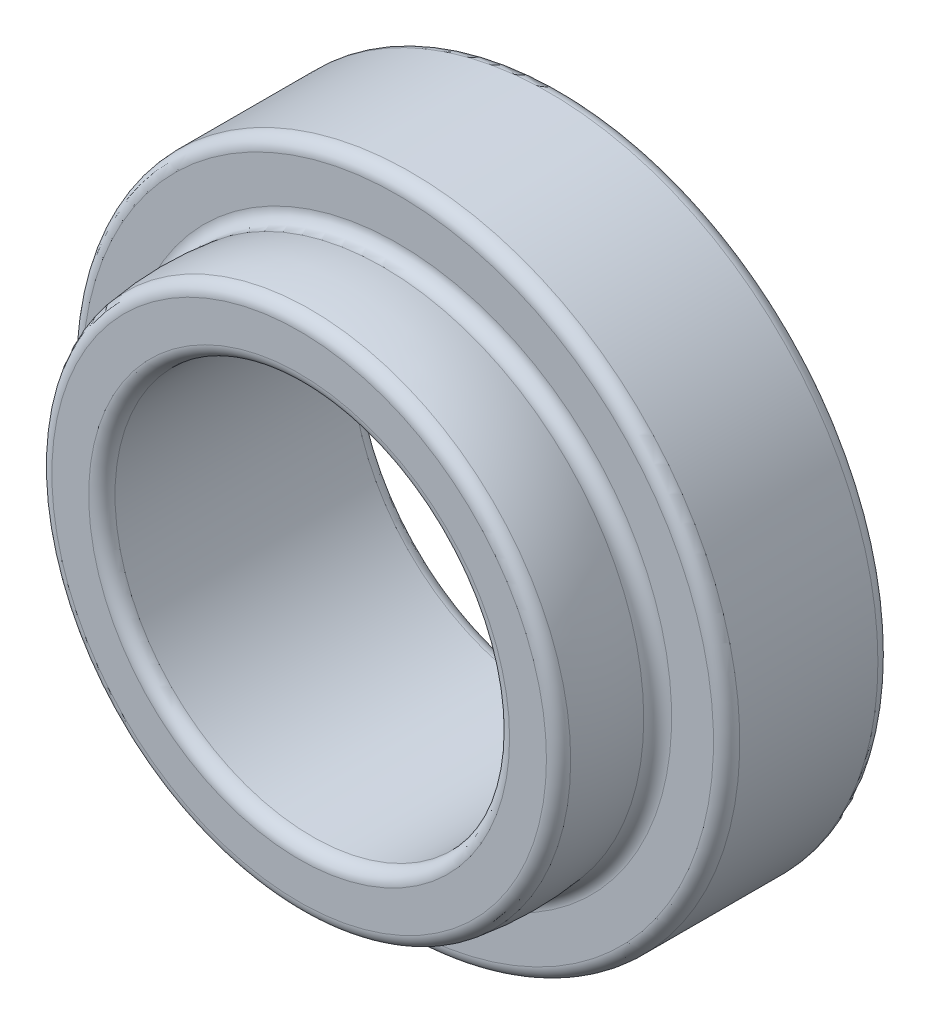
SolidWorks part; units mm, degrees
ref_plane "Face" through (0, 0, 0) normal (0, 0, 1) x (1, 0, 0)
ref_plane "Dessus" through (0, 0, 0) normal (0, 1, 0) x (1, 0, 0)
ref_plane "Droite" through (0, 0, 0) normal (1, 0, 0) x (0, 0, -1)
sketch "Esquisse1" plane through (0, 0, 0) normal (0, 0, 1) x (1, 0, 0)
  circle A0 centre (0, 0) radius 3
  circle A1 centre (0, 0) radius 3.5
  dimension "D1" = 6
  dimension "D2" = 7
extrude "Extrusion1" add sketch "Esquisse1" along normal blind 4
sketch "Esquisse2" plane through (0, 0, 0) normal (0, 0, -1) x (-1, 0, 0)
  circle A0 centre (0, 0) radius 3 construction
  circle A1 centre (0, 0) radius 3
  circle A2 centre (0, 0) radius 5
  dimension "D1" = 10
extrude "Extrusion2" add sketch "Esquisse2" against normal blind 2.5
sketch "Esquisse3" plane through (0, 0, 0) normal (0, 1, 0) x (1, 0, 0)
  line L0 (0, 0) -> (0, -5.3188) construction
  line L1 (-3.5, -4) -> (3.5, -4) construction
  line L2 (3, -4) -> (3.9291, -4)
  line L5 (3, -4) -> (3, 0) construction
  line L6 (3, -4) -> (3, -2.5)
  line L7 (3, -2.5) -> (3.9291, -2.5)
  arc A1 (3.9291, -4) -> (3.9291, -2.5) centre (0, -3.25) ccw
revolve "Révolution1" add sketch "Esquisse3" angle 360 about L0
fillet "Congé1" radius 0.2
